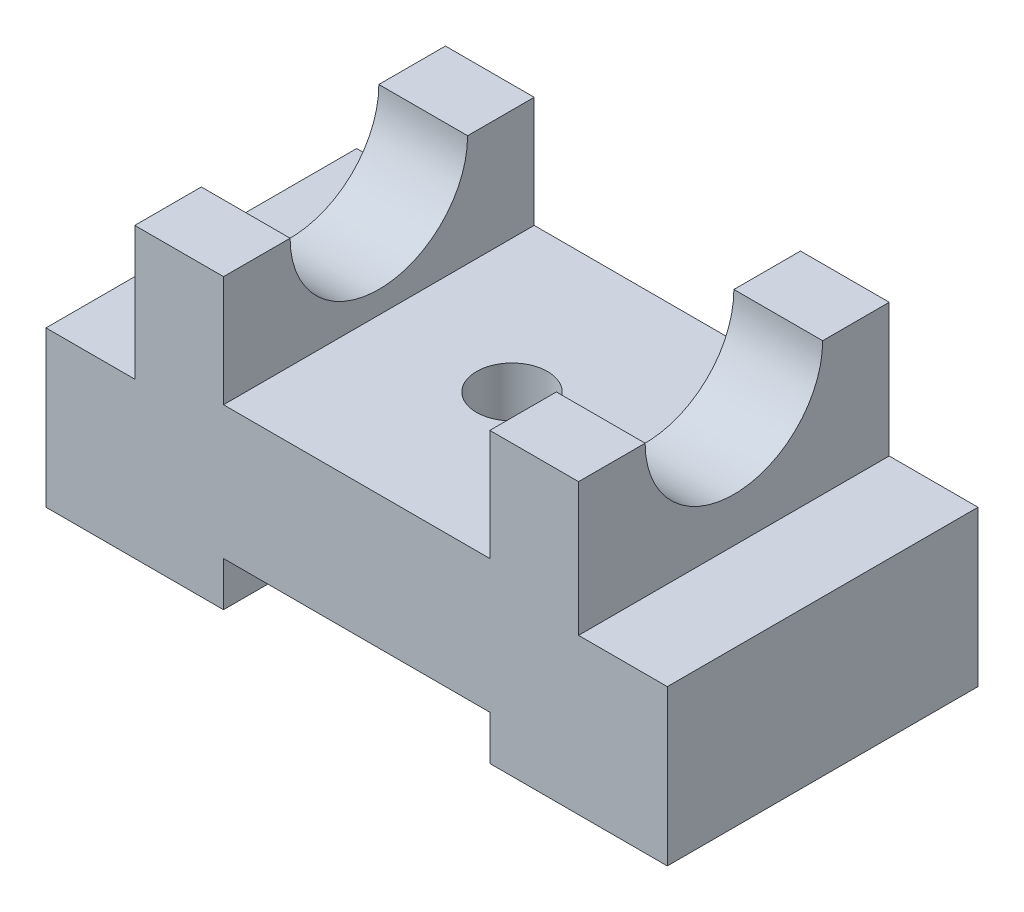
SolidWorks part; units mm, degrees
ref_plane "Front Plane" through (0, 0, 0) normal (0, 0, 1) x (1, 0, 0)
ref_plane "Top Plane" through (0, 0, 0) normal (0, 1, 0) x (1, 0, 0)
ref_plane "Right Plane" through (0, 0, 0) normal (1, 0, 0) x (0, 0, -1)
sketch "Sketch1" plane through (0, 0, 0) normal (0, 0, 1) x (1, 0, 0)
  line L0 (0, 0) -> (0, -44.4689) construction
  line L1 (-30, 0) -> (30, 0)
  line L2 (-30, 0) -> (-30, 25)
  line L3 (-30, 25) -> (-50, 25)
  line L4 (-50, 25) -> (-50, -5)
  line L5 (-50, -5) -> (-70, -5)
  line L6 (-70, -5) -> (-70, -40)
  line L7 (-70, -40) -> (-30, -40)
  line L8 (30, 0) -> (30, 25)
  line L9 (30, 25) -> (50, 25)
  line L10 (50, 25) -> (50, -5)
  line L11 (50, -5) -> (70, -5)
  line L12 (70, -5) -> (70, -40)
  line L13 (70, -40) -> (30, -40)
  line L14 (30, -40) -> (30, -30)
  line L15 (30, -30) -> (-30, -30)
  line L16 (-30, -30) -> (-30, -40)
  dimension "D1" = 60
  dimension "D2" = 20
  dimension "D3" = 10
  dimension "D4" = 35
  dimension "D5" = 40
  dimension "D6" = 65
  dimension "D7" = 20
  dimension "D8" = 60
extrude "Boss-Extrude1" add sketch "Sketch1" along normal mid plane 70
sketch "Sketch2" plane through (50, 0, 0) normal (1, 0, 0) x (0, 0, -1)
  line L0 (-35, 25) -> (35, 25) construction
  circle A0 centre (0, 25) radius 20
  dimension "D1" = 40
extrude "Cut-Extrude1" cut sketch "Sketch2" against normal through all
sketch "Sketch3" plane through (0, 0, 0) normal (0, 1, 0) x (1, 0, 0)
  circle A0 centre (0, 0) radius 8
  dimension "D1" = 16
extrude "Cut-Extrude2" cut sketch "Sketch3" against normal through all
